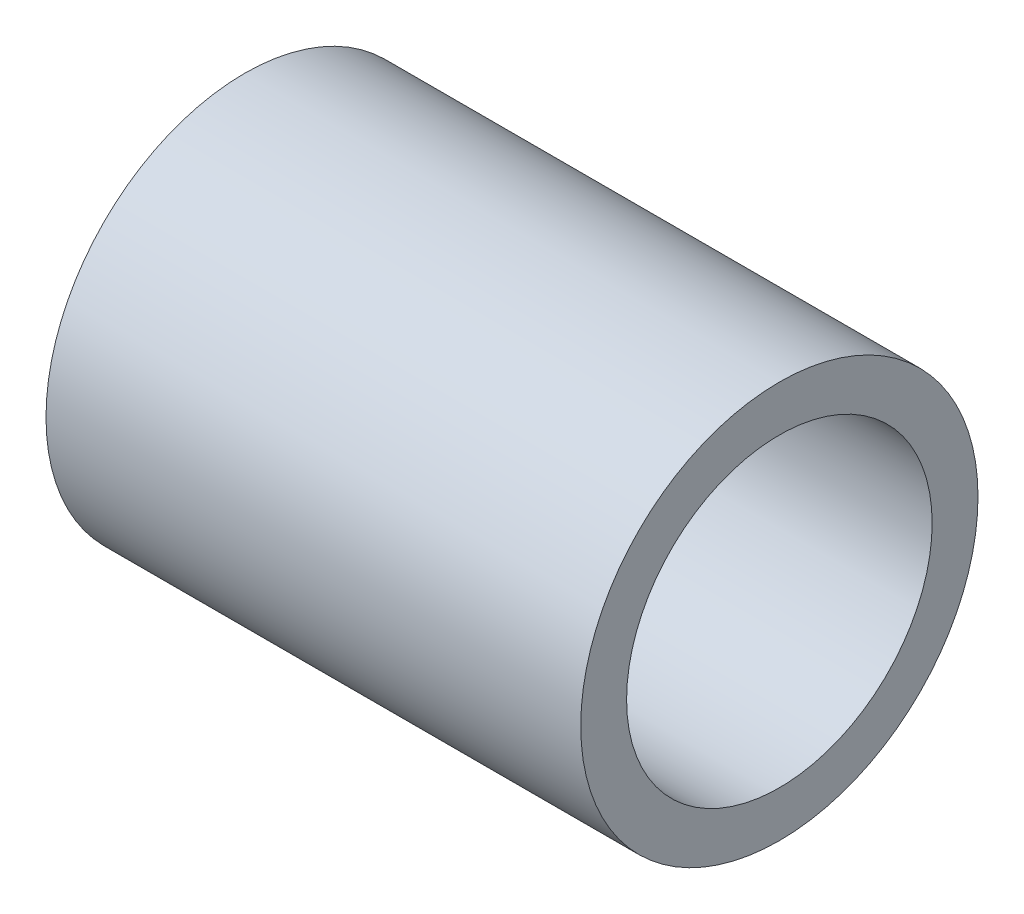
SolidWorks part; units mm, degrees
ref_plane "Front" through (0, 0, 0) normal (0, 0, 1) x (1, 0, 0)
ref_plane "Top" through (0, 0, 0) normal (0, 1, 0) x (1, 0, 0)
ref_plane "Right" through (0, 0, 0) normal (1, 0, 0) x (0, 0, -1)
sketch "Sketch1" plane through (0, 0, 0) normal (0, 0, 1) x (1, 0, 0)
  line L0 (0, 0) -> (44.45, 0)
  line L1 (9.9848, 0) -> (-9.9848, 0) construction
  dimension "D1" = 44.45
other "Structural Member1"
ref_plane "Plane1" through (0, 0, 0) normal (1, 0, 0) x (0, 0, -1)
sketch "Sketch11" plane through (0, 0, 0) normal (1, 0, 0) x (0, 0, -1)
  circle A0 centre (0, 0) radius 12.7
  circle A1 centre (0, 0) radius 16.51
  point P3 (0, 0)
  dimension "D1" = 33.02
  dimension "D2" = 25.4
